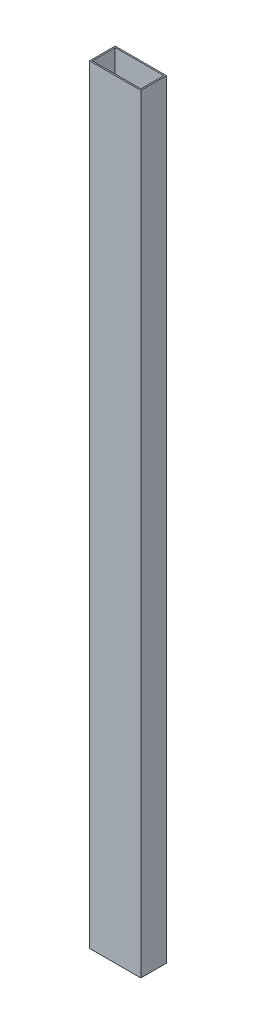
SolidWorks part; units mm, degrees
ref_plane "Plan de face" through (0, 0, 0) normal (0, 0, 1) x (1, 0, 0)
ref_plane "Plan de dessus" through (0, 0, 0) normal (0, 1, 0) x (1, 0, 0)
ref_plane "Plan de droite" through (0, 0, 0) normal (1, 0, 0) x (0, 0, -1)
sketch "Esquisse1" plane through (0, 0, 0) normal (0, 1, 0) x (1, 0, 0)
  line L1 (-40, 20) -> (40, 20)
  line L2 (-40, 20) -> (-40, -20)
  line L3 (-40, -20) -> (40, -20)
  line L4 (40, 20) -> (40, -20)
  line L5 (-40, 20) -> (40, -20) construction
  line L6 (-40, -20) -> (40, 20) construction
  line L11 (-38, 18) -> (38, 18)
  line L12 (-38, 18) -> (-38, -18)
  line L13 (-38, -18) -> (38, -18)
  line L14 (38, 18) -> (38, -18)
  line L15 (-38, 18) -> (38, -18) construction
  line L16 (-38, -18) -> (38, 18) construction
  point P0 (0, 0)
  point P6 (0, 0)
  point P7 (0, 0)
  dimension "D1" = 80
  dimension "D2" = 40
  dimension "D3" = 36
  dimension "D4" = 76
extrude "Boss.-Extru.1" add sketch "Esquisse1" along normal blind 1200
